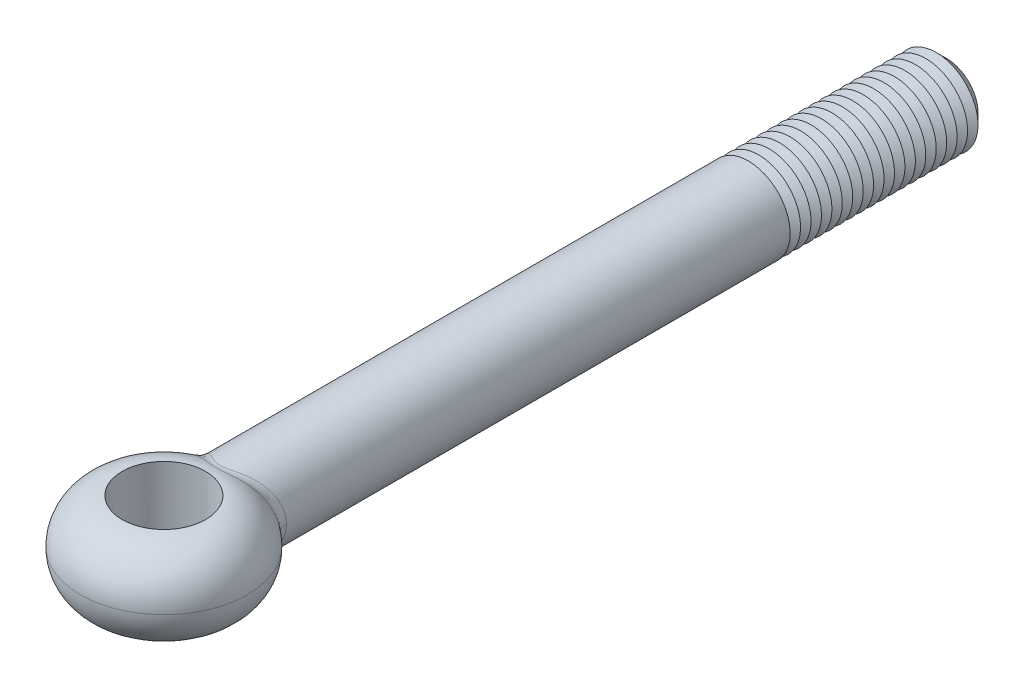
SolidWorks part; units mm, degrees
ref_plane "Front Plane" through (0, 0, 0) normal (0, 0, 1) x (1, 0, 0)
ref_plane "Top Plane" through (0, 0, 0) normal (0, 1, 0) x (1, 0, 0)
ref_plane "Right Plane" through (0, 0, 0) normal (1, 0, 0) x (0, 0, -1)
sketch "Sketch7" plane through (0, 0, 0) normal (0, 1, 0) x (1, 0, 0)
  circle A0 centre (0, 0) radius 16
  dimension "D1" = 32
extrude "Boss-Extrude3" add sketch "Sketch7" along normal mid plane 17
sketch "Sketch8" plane through (0, 0, 0) normal (0, 0, 1) x (1, 0, 0)
  circle A0 centre (0, 0) radius 8
  dimension "D1" = 16
extrude "Boss-Extrude4" add sketch "Sketch8" against normal blind 150
fillet "Fillet5" radius 8.5 2 edges at (0, -8.5, 16) (0, 8.5, 16)
fillet "Fillet6" radius 3 2 edges at (-0.1803, -7.998, -10.3764) (0.1803, 7.998, -10.3764)
chamfer "Chamfer1" distance 2 angle 45 1 edges at (8, 0, -150)
sketch "Sketch10" plane through (0, 0, 0) normal (0, 1, 0) x (1, 0, 0)
  line L0 (0, 28.1405) -> (0, -7.9233) construction
sketch "Sketch11" plane through (0, 0, 0) normal (0, 1, 0) x (1, 0, 0)
  line L0 (-8, 112) -> (-6.2679, 113)
  line L1 (-8, 148) -> (-8, 15.4919) construction
  line L2 (-6.2679, 113) -> (-8, 114)
  line L3 (-8, 114) -> (-8, 112)
  line L4 (6, 150) -> (-6, 150) construction
  dimension "D1" = 2
  dimension "D2" = 38
revolve "Cut-Revolve1" cut sketch "Sketch11" angle 360 about L0
pattern_linear "LPattern1" count 18 spacing 2 along (0, 0, -1) of "Cut-Revolve1"
sketch "Sketch12" plane through (0, 0, 0) normal (0, 1, 0) x (1, 0, 0)
  circle A0 centre (0, 0) radius 8
  dimension "D1" = 16
extrude "Cut-Extrude1" cut sketch "Sketch12" against normal mid plane 17
